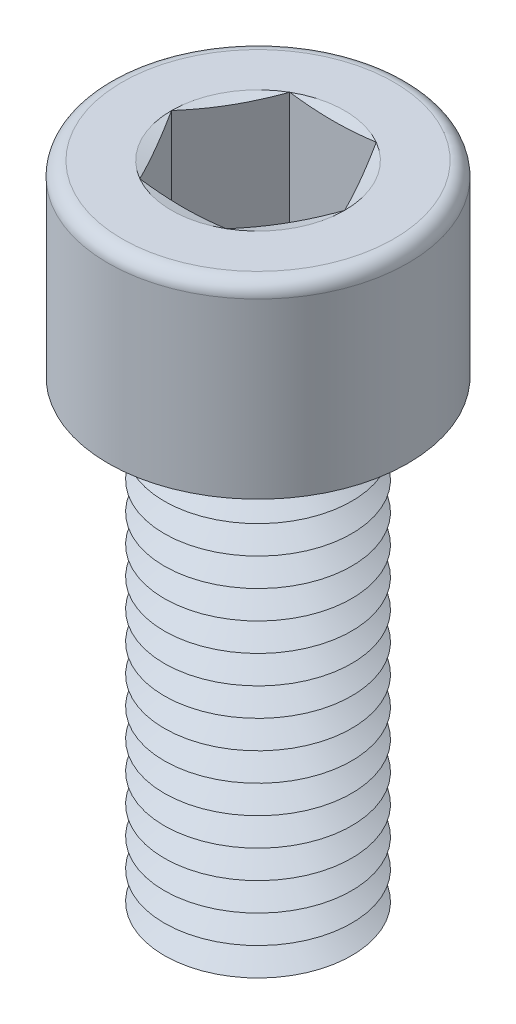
SolidWorks part; units mm, degrees
ref_plane "Front Plane" through (0, 0, 0) normal (0, 0, 1) x (1, 0, 0)
ref_plane "Top Plane" through (0, 0, 0) normal (0, 1, 0) x (1, 0, 0)
ref_plane "Right Plane" through (0, 0, 0) normal (1, 0, 0) x (0, 0, -1)
sketch "Sketch1" plane through (0, 0, 0) normal (0, 1, 0) x (1, 0, 0)
  circle A0 centre (0, 0) radius 5
  dimension "D1" = 10
extrude "Extrude1" add sketch "Sketch1" along normal blind 25
sketch "Sketch2" plane through (0, 25, 0) normal (0, 1, 0) x (1, 0, 0)
  circle A0 centre (0, 0) radius 8
  dimension "D1" = 16
extrude "Extrude2" add sketch "Sketch2" along normal blind 10
sketch "Sketch3" plane through (0, 35, 0) normal (0, 1, 0) x (1, 0, 0)
  line L1 (2.3094, 4) -> (-2.3094, 4)
  line L2 (-2.3094, 4) -> (-4.6188, 0)
  line L3 (-4.6188, 0) -> (-2.3094, -4)
  line L4 (-2.3094, -4) -> (2.3094, -4)
  line L5 (2.3094, -4) -> (4.6188, 0)
  line L6 (4.6188, 0) -> (2.3094, 4)
  circle A0 centre (0, 0) radius 4 construction
  dimension "D1" = 8
extrude "Extrude3" cut sketch "Sketch3" against normal blind 8
fillet "Fillet1" radius 0.75 1 edges at (0, 35, 8)
sketch "Sketch4" plane through (0, 0, 0) normal (1, 0, 0) x (0, 0, -1)
  line L0 (-4, 27) -> (0, 27)
  line L1 (0, 27) -> (0, 24.6906)
  line L2 (0, 24.6906) -> (-4, 27)
  dimension "D1" = 30
revolve "Cut-Revolve1" cut sketch "Sketch4" angle 360 about L1
sketch "Sketch5" plane through (0, 0, 0) normal (0, 0, 1) x (1, 0, 0)
  line L0 (-5, 0.75) -> (-5, -0.75)
  line L1 (-5, 25) -> (-5, 0) construction
  line L2 (-5, -0.75) -> (-3.701, 0)
  line L3 (-5, 0) -> (5, 0) construction
  line L4 (-3.701, 0) -> (-5, 0.75)
  dimension "D1" = 1.5
revolve "Cut-Revolve2" cut sketch "Sketch5" angle 360 about axis through (0, 25, 0) along (0, -1, 0)
pattern_linear "LPattern1" count 17 spacing 1.5 along (0, 1, 0) of "Cut-Revolve2"
sketch "Sketch6" plane through (0, 35, 0) normal (0, 1, 0) x (1, 0, 0)
  circle A0 centre (0, 0) radius 4.6188
extrude "Extrude4" cut sketch "Sketch6" against normal through all draft 75
